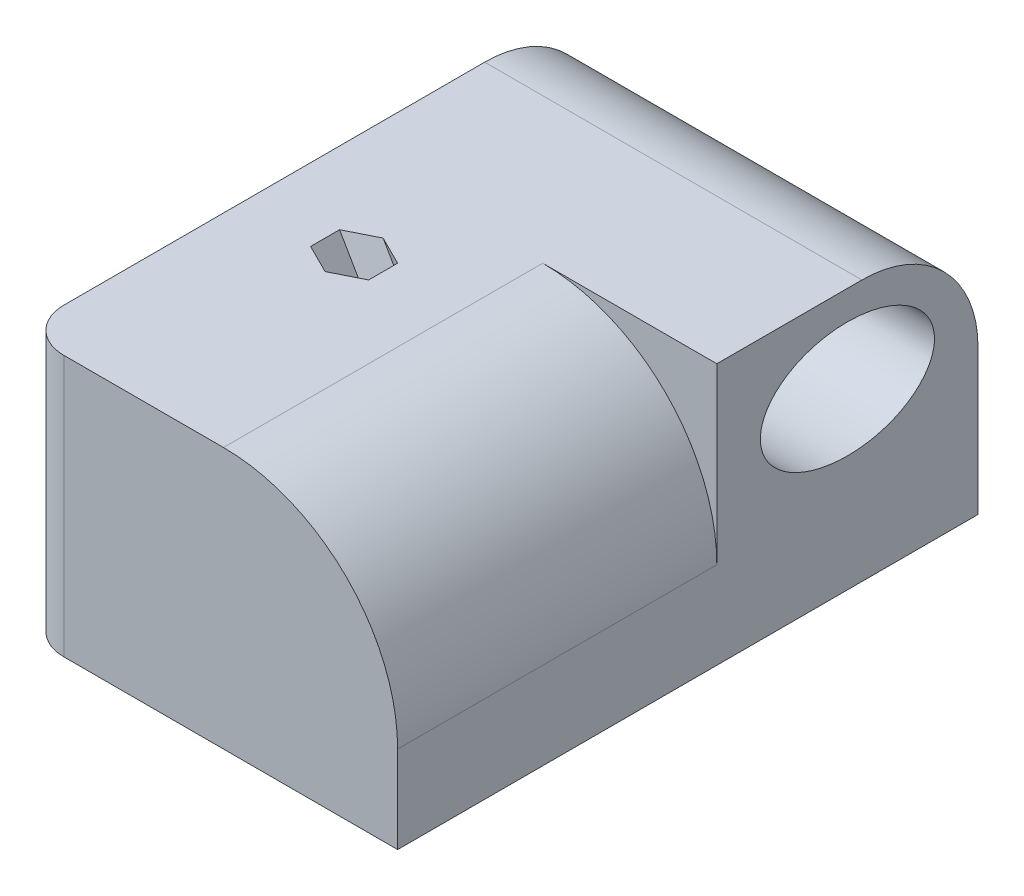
SolidWorks part; units mm, degrees
ref_plane "Front Plane" through (0, 0, 0) normal (0, 0, 1) x (1, 0, 0)
ref_plane "Top Plane" through (0, 0, 0) normal (0, 1, 0) x (1, 0, 0)
ref_plane "Right Plane" through (0, 0, 0) normal (1, 0, 0) x (0, 0, -1)
sketch "Sketch1" plane through (0, 0, 0) normal (0, 1, 0) x (1, 0, 0)
  line L1 (-65, -100) -> (65, -100)
  line L2 (-65, -100) -> (-65, 100)
  line L3 (-65, 100) -> (65, 100)
  line L4 (65, -100) -> (65, 100)
  line L5 (-65, -100) -> (65, 100) construction
  line L6 (-65, 100) -> (65, -100) construction
  point P0 (0, 0)
  dimension "D1" = 130
  dimension "D2" = 200
extrude "Boss-Extrude1" add sketch "Sketch1" along normal blind 90 contours L4 L3 L2 L1
ref_point "Point1" parameters "D1"=110
fillet "Fillet2" radius 15 1 edges at (-65, 45, 100)
sketch "Sketch3" plane through (0, 90, 0) normal (0, 1, 0) x (1, 0, 0)
  line L0 (-65, -85) -> (-65, 100) construction
  line L1 (65, -100) -> (65, 100) construction
  point P0 (-30, -20)
  point P3 (65, 10)
  dimension "D1" = 35
  dimension "D2" = 110
  dimension "D3" = 30
ref_plane "Plane4" through (-22.7211, 39.3542, 0) normal (-0.5, 0.866, 0) x (0, 0, -1)
sketch "Sketch5" plane through (-22.7211, 39.3542, 0) normal (-0.5, 0.866, 0) x (0, 0, -1)
  line L1 (-10, -19.0192) -> (-15, -10.359)
  line L2 (-15, -10.359) -> (-25, -10.359)
  line L3 (-25, -10.359) -> (-30, -19.0192)
  line L4 (-30, -19.0192) -> (-25, -27.6795)
  line L5 (-25, -27.6795) -> (-15, -27.6795)
  line L6 (-15, -27.6795) -> (-10, -19.0192)
  circle A0 centre (-20, -19.0192) radius 8.6603 construction
  dimension "D1" = 10
extrude "Cut-Extrude1" cut sketch "Sketch5" against normal through all and the other way through all
fillet "Fillet3" radius 60 1 edges at (65, 90, 0)
sketch "Sketch7" plane through (65, 0, 0) normal (1, 0, 0) x (0, 0, -1)
  line L0 (10, 90) -> (100, 90) construction
  line L1 (100, 90) -> (100, 0) construction
  ellipse E0 centre (55, 60) end of major axis (25, 60) minor radius 20
  dimension "D1" = 30
  dimension "D2" = 45
  dimension "D3" = 60
  dimension "D4" = 20
extrude "Cut-Extrude2" cut sketch "Sketch7" against normal blind 115
fillet "Fillet4" radius 40 1 edges at (0, 90, -100)
